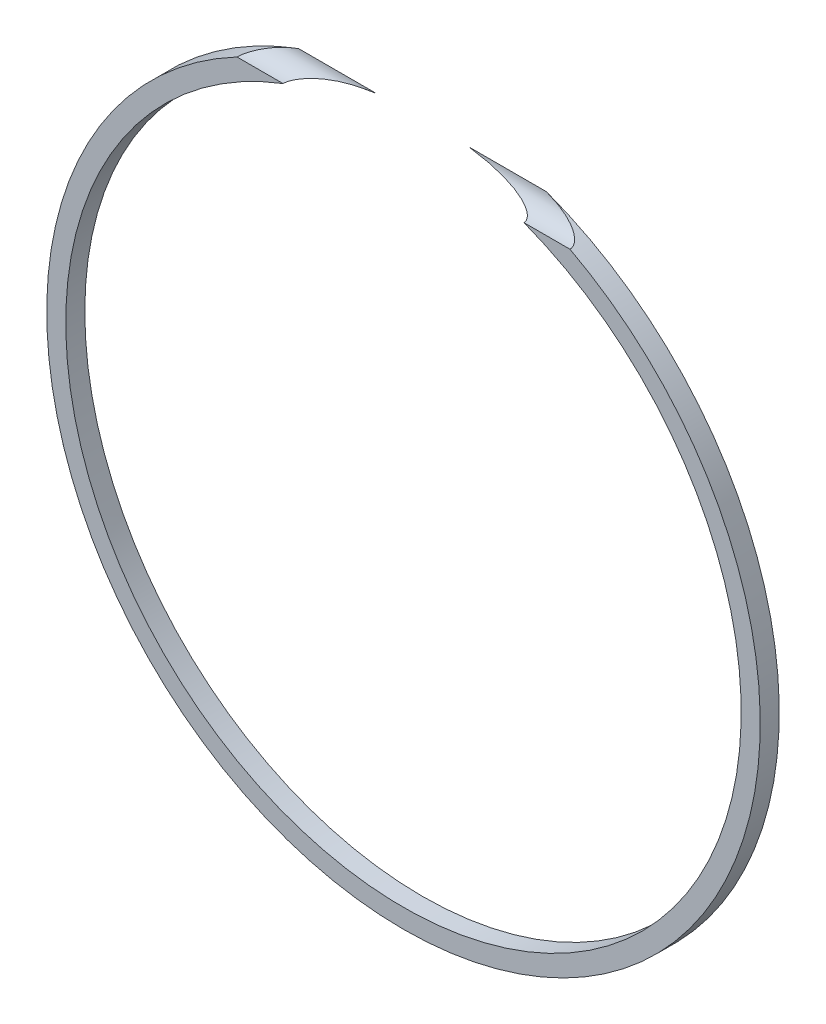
SolidWorks part; units mm, degrees
ref_plane "Plan de face" through (0, 0, 0) normal (0, 0, 1) x (1, 0, 0)
ref_plane "Plan de dessus" through (0, 0, 0) normal (0, 1, 0) x (1, 0, 0)
ref_plane "Plan de droite" through (0, 0, 0) normal (1, 0, 0) x (0, 0, -1)
sketch "Esquisse1" plane through (0, 0, 0) normal (0, 0, 1) x (1, 0, 0)
  circle A0 centre (0, 0) radius 22.5
  circle A1 centre (0, 0) radius 21.3
  dimension "D1" = 1.2
  dimension "D2" = 45
extrude "Boss.-Extru.1" add sketch "Esquisse1" along normal blind 1.2
sketch "Esquisse2" plane through (0, 0, 1.2) normal (0, 0, 1) x (1, 0, 0)
  line L0 (-10.5, 19.8997) -> (10.5, 19.8997) construction
  circle A0 centre (0, 0) radius 22.5 construction
  point P5 (10.5, 19.8997)
  dimension "D1" = 21
sketch "Esquisse3" plane through (0, 0, 0) normal (1, 0, 0) x (0, 0, -1)
  line L0 (-1.2, 22.5) -> (-1.2, -22.5) construction
  line L1 (0, 21.0997) -> (0, 23.4432)
  line L2 (0, 23.4432) -> (-4.4666, 23.4432)
  line L3 (-4.4666, 23.4432) -> (-2.383, 21.3008)
  arc A0 (-2.383, 21.3008) -> (0, 21.0997) centre (-1.2, 21.0997) ccw
  dimension "D1" = 2.4
extrude "Enlèv. mat.-Extru.1" cut sketch "Esquisse3" against normal through all both and the other way through all
